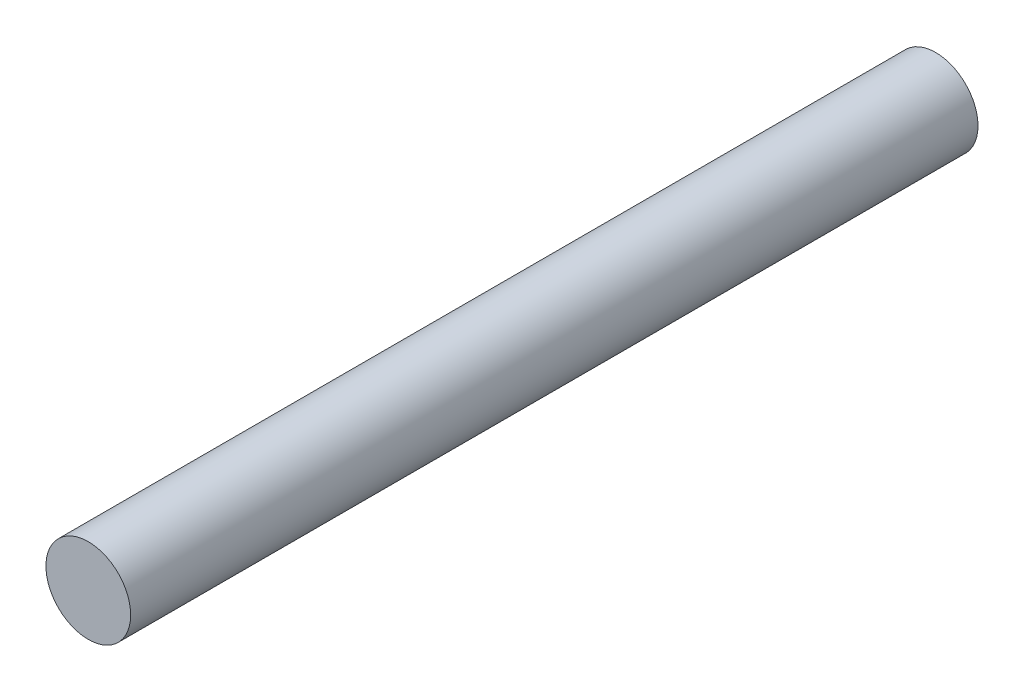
SolidWorks part; units mm, degrees
ref_plane "Front Plane" through (0, 0, 0) normal (0, 0, 1) x (1, 0, 0)
ref_plane "Top Plane" through (0, 0, 0) normal (0, 1, 0) x (1, 0, 0)
ref_plane "Right Plane" through (0, 0, 0) normal (1, 0, 0) x (0, 0, -1)
sketch "Sketch1" plane through (0, 0, 0) normal (0, 0, 1) x (1, 0, 0)
  circle A0 centre (0, 0) radius 30
  dimension "D1" = 60
extrude "Boss-Extrude1" add sketch "Sketch1" against normal blind 600
